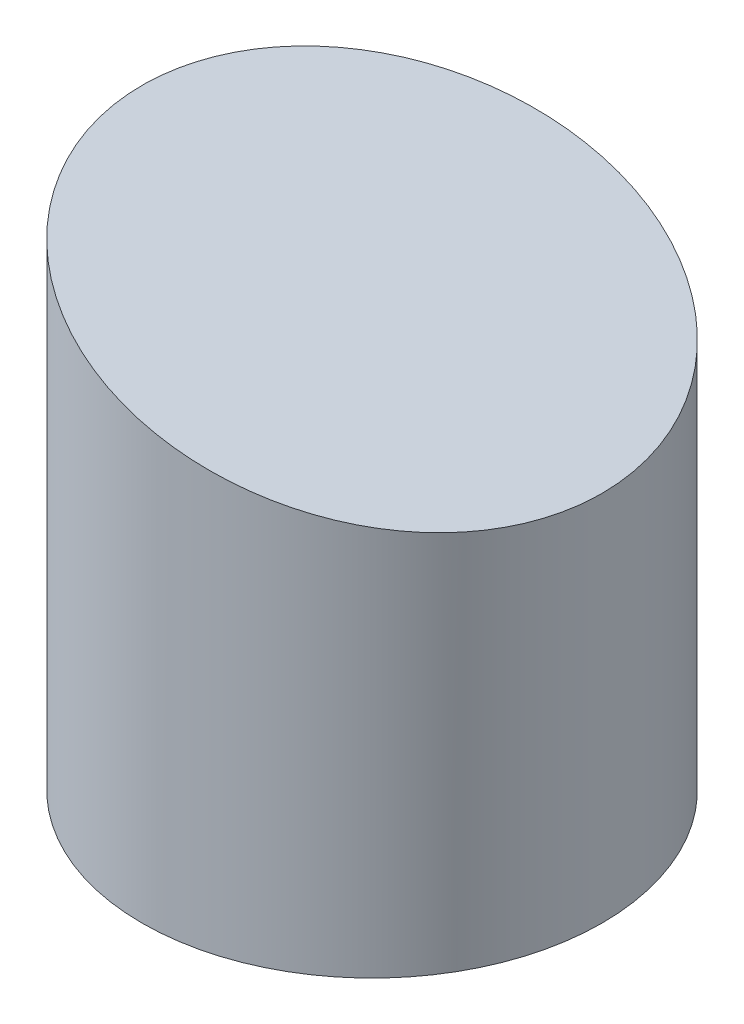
SolidWorks part; units mm, degrees
ref_plane "Front Plane" through (0, 0, 0) normal (0, 0, 1) x (1, 0, 0)
ref_plane "Top Plane" through (0, 0, 0) normal (0, 1, 0) x (1, 0, 0)
ref_plane "Right Plane" through (0, 0, 0) normal (1, 0, 0) x (0, 0, -1)
sketch "Sketch1" plane through (0, 0, 0) normal (0, 1, 0) x (1, 0, 0)
  circle A0 centre (0, 0) radius 32.5
  dimension "D1" = 65
extrude "Boss-Extrude1" add sketch "Sketch1" along normal mid plane 70
sketch "Sketch2" plane through (0, 0, 0) normal (0, 0, 1) x (1, 0, 0)
  line L0 (-32.5, 35) -> (32.5, 17.5833)
  line L1 (32.5, -35) -> (32.5, 35) construction
  line L2 (32.5, 35) -> (-32.5, 35) construction
  dimension "D1" = 15
extrude "Cut-Extrude1" cut sketch "Sketch2" against normal through all both and the other way through all
